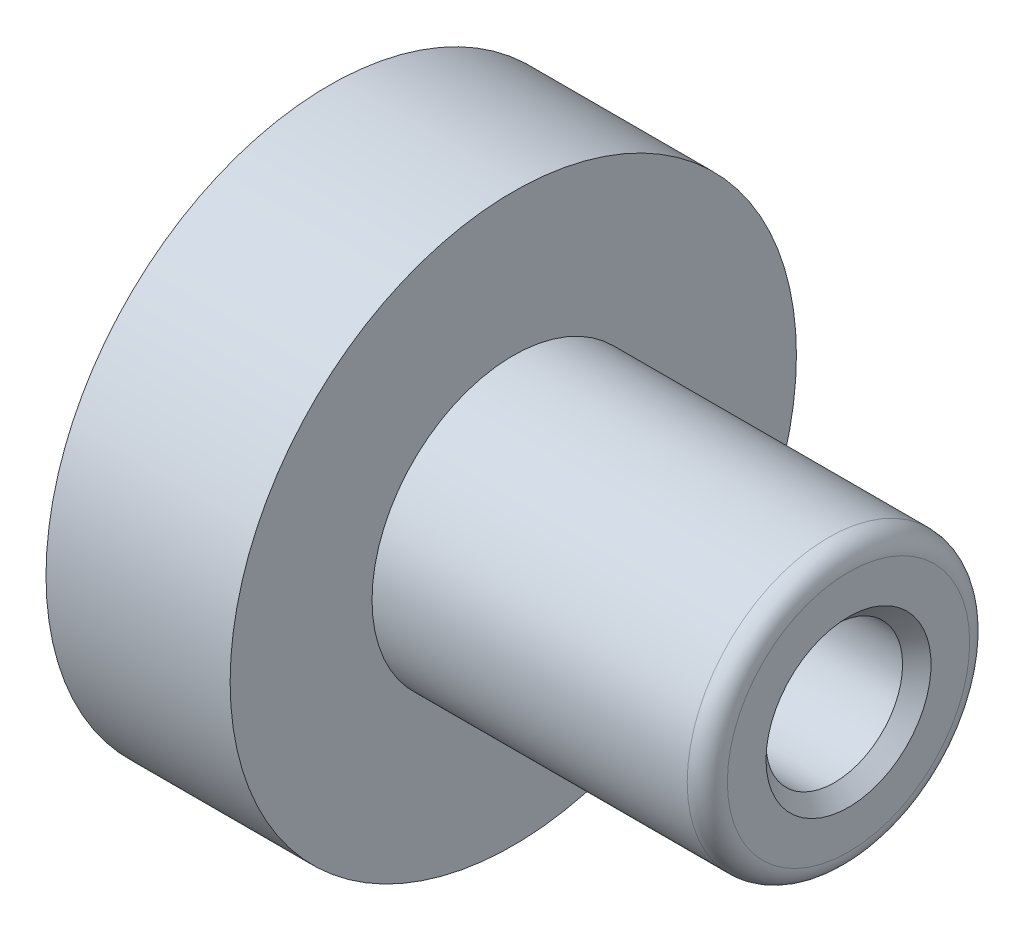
SolidWorks part; units mm, degrees
ref_plane "Front Plane" through (0, 0, 0) normal (0, 0, 1) x (1, 0, 0)
ref_plane "Top Plane" through (0, 0, 0) normal (0, 1, 0) x (1, 0, 0)
ref_plane "Right Plane" through (0, 0, 0) normal (1, 0, 0) x (0, 0, -1)
sketch "Sketch1" plane through (0, 0, 0) normal (0, 0, 1) x (1, 0, 0)
  line L0 (0, 0) -> (102.3864, 0) construction
  line L1 (0, 8.128) -> (0, 22.225)
  line L2 (0, 22.225) -> (14.4526, 22.225)
  line L3 (14.4526, 22.225) -> (14.4526, 11.0871)
  line L4 (14.4526, 11.0871) -> (39.1922, 11.0871)
  line L5 (40.767, 9.5123) -> (40.767, 0)
  line L6 (40.767, 0) -> (28.067, 0)
  line L7 (0, 8.128) -> (28.067, 8.128)
  line L8 (28.067, 8.128) -> (28.067, 0)
  arc A0 (40.767, 9.5123) -> (39.1922, 11.0871) centre (39.1922, 9.5123) ccw
  dimension "D5" = 1.5748
  dimension "D1" = 14.4526
  dimension "D2" = 44.45
  dimension "D3" = 28.067
  dimension "D4" = 16.256
  dimension "D6" = 40.767
  dimension "D7" = 22.1742
revolve "Revolve1" add sketch "Sketch1" angle 360 about L0
sketch "Sketch2" plane through (0, 0, 0) normal (-1, 0, 0) x (0, 0, 1)
  line L0 (0, 0) -> (0, 9.7644) construction
  circle A0 centre (-12.7, 0) radius 3.2004
  circle A1 centre (12.7, 0) radius 3.2004
  dimension "D2" = 6.4008
  dimension "D1" = 25.4
extrude "Cut-Extrude1" cut sketch "Sketch2" against normal blind 7.9502
sketch "Sketch3" plane through (40.767, 0, 0) normal (1, 0, 0) x (0, 0, -1)
  circle A0 centre (0, 0) radius 5.3594
  dimension "D1" = 10.7188
extrude "Cut-Extrude2" cut sketch "Sketch3" against normal through all
chamfer "Chamfer1" distance 1.1176 angle 45 1 edges at (40.767, 0, -5.3594)
